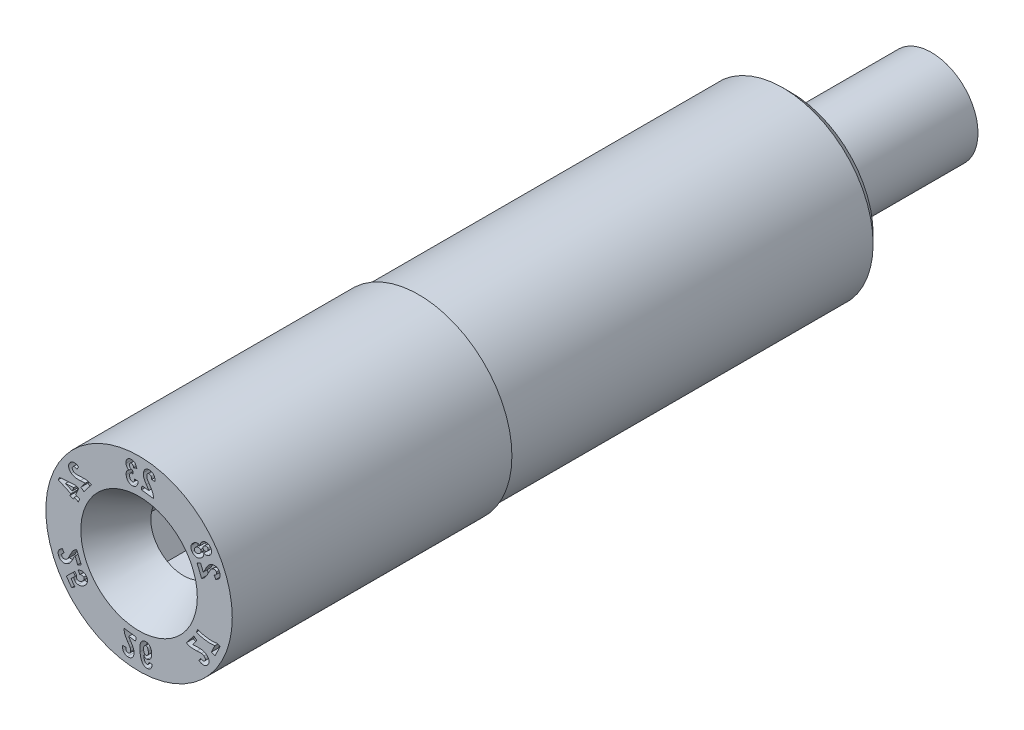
SolidWorks part; units mm, degrees
other "<M2L6-SetScrew>-<Chamfer1>"
ref_plane "Front Plane" through (0, 0, 0) normal (0, 0, 1) x (1, 0, 0)
ref_plane "Top Plane" through (0, 0, 0) normal (0, 1, 0) x (1, 0, 0)
ref_plane "Right Plane" through (0, 0, 0) normal (1, 0, 0) x (0, 0, -1)
sketch "Sketch1" plane through (0, 0, 0) normal (1, 0, 0) x (0, 0, -1)
  line L0 (0.9526, 0.7) -> (0, 1.25)
  line L2 (0, 2) -> (0, 1.25)
  line L3 (13.75, 2) -> (0, 2)
  line L4 (-3.7979, 0) -> (49996.2021, 0) construction
  line L8 (11, 0.7) -> (0.9526, 0.7)
  line L12 (14, 1) -> (14, 1.75)
  line L16 (14, 1.75) -> (13.75, 2)
  line L17 (14, 1) -> (11, 1)
  line L18 (11, 0.7) -> (11, 1)
  dimension "D1" = 14
  dimension "D2" = 45
  dimension "D3" = 0.25
  dimension "D4" = 4
  dimension "D5" = 30
  dimension "D6" = 1.25
  dimension "D7" = 1.4
  dimension "D8" = 2
  dimension "D9" = 3
revolve "Revolve1" add sketch "Sketch1" angle 360 about L4
sketch "Sketch5" plane through (0, 0, 0) normal (1, 0, 0) x (0, 0, -1)
  line L0 (0, 0) -> (50000, 0) construction
  line L1 (0, 2) -> (0, -2) construction
  line L2 (6, 1.935) -> (14, 1.935)
  line L3 (6, 1.935) -> (6, 2.935)
  line L4 (6, 2.935) -> (14, 2.935)
  line L5 (14, 1.935) -> (14, 2.935)
  line L6 (14, -1.75) -> (14, 1.75) construction
  line L7 (13.75, 2) -> (0, 2) construction
  dimension "D1" = 6
  dimension "D2" = 0.065
  dimension "D3" = 1
revolve "Cut-Revolve1" cut sketch "Sketch5" angle 360 about L0
sketch "Sketch2" plane through (0, 0, 0) normal (0, 0, 1) x (1, 0, 0)
  line L0 (0, 0) -> (0, 2) construction
  line L1 (0, 0) -> (1.7321, 1) construction
  line L2 (0, 0) -> (1.7321, -1) construction
  line L3 (0, 0) -> (0, -2) construction
  line L4 (0, 0) -> (-1.7321, -1) construction
  line L5 (0, 0) -> (-1.7321, 1) construction
  circle A0 centre (0, 0) radius 2 construction
  arc A1 (0.3222, 1.3624) -> (0.723, 1.1989) centre (0, 0) ccw construction
  text T0 "23     24     25     26     27     28" font "Arial Narrow" height 0.47
  point P12 (0, 0)
  point P15 (0, 0)
  point P17 (0, 0)
  point P21 (0, 0)
  dimension "D1" = 6
  dimension "D2" = 2.8
extrude "Cut-Extrude1" cut sketch "Sketch2" against normal blind 0.15
ref_plane "Plane1" through (0, 0, -0.9526) normal (0, 0, 1) x (1, 0, 0)
sketch "Sketch6" plane through (0, 0, -0.9526) normal (0, 0, 1) x (1, 0, 0)
  line L1 (-0.8079, 0.0246) -> (-0.4253, -0.6874)
  line L2 (-0.4253, -0.6874) -> (0.3826, -0.712)
  line L3 (0.3826, -0.712) -> (0.8079, -0.0246)
  line L4 (0.8079, -0.0246) -> (0.4253, 0.6874)
  line L5 (0.4253, 0.6874) -> (-0.3826, 0.712)
  line L6 (-0.3826, 0.712) -> (-0.8079, 0.0246)
  circle A0 centre (0, 0) radius 0.7 construction
  circle A1 centre (0, 0) radius 0.7 construction
extrude "Cut-Extrude2" cut sketch "Sketch6" against normal blind 1.4
inserted part "M2L6-SetScrew"
move or copy body "Body-Move/Copy2" placed by mates yes
other "Distance1" parameters "D1"=3
